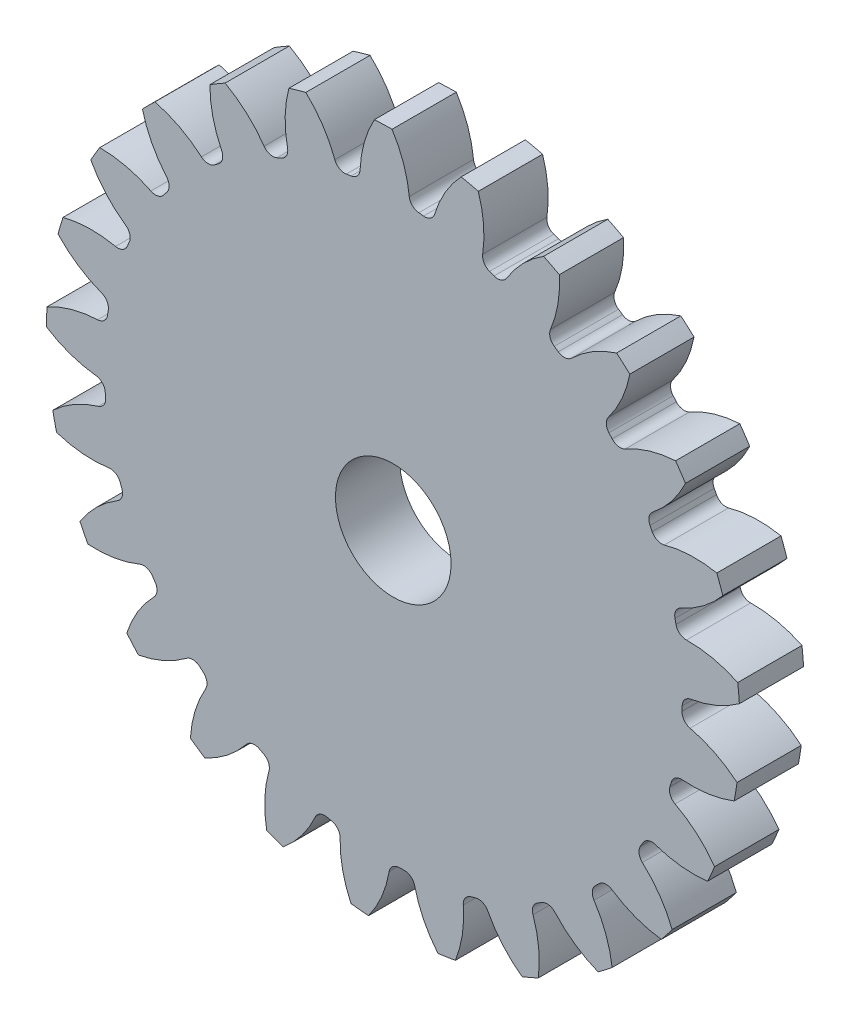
SolidWorks part; units mm, degrees
ref_plane "Front" through (0, 0, 0) normal (0, 0, 1) x (1, 0, 0)
ref_plane "Top" through (0, 0, 0) normal (0, 1, 0) x (1, 0, 0)
ref_plane "Right" through (0, 0, 0) normal (1, 0, 0) x (0, 0, -1)
sketch "Sketch3" plane through (0, 0, 0) normal (0, 0, 1) x (1, 0, 0)
  circle A0 centre (0, 0) radius 685.8
  dimension "od" = 1371.6
extrude "gearBody" add sketch "Sketch3" along normal blind 127
sketch "Sketch2" plane through (0, 0, 0) normal (0, 0, 1) x (1, 0, 0)
  line L0 (0, 0) -> (551.2834, 228.349) construction
  line L1 (681.0714, -92.9053) -> (0, 0) construction
  line L2 (0, 0) -> (36.3143, 0) construction
  line L3 (634.7401, 18.1669) -> (632.0519, -61.1178) construction
  line L5 (633.396, -21.4755) -> (0, 0) construction
  line L7 (0, 0) -> (596.7048, 0) construction
  arc A0 (596.666, 6.8045) -> (594.8349, -47.2027) centre (0, 0) ccw construction
  arc A1 (684.292, 45.4549) -> (679.6417, -91.6994) centre (0, 0) ccw construction
  arc A2 (634.7401, 18.1669) -> (632.0519, -61.1178) centre (0, 0) ccw construction
  arc A3 (570.9889, -24.1643) -> (571.3144, -14.5658) centre (0, 0) ccw
  arc A4 (681.0714, -92.9053) -> (586.8633, -45.1533) centre (534.5507, -265.1645) ccw
  arc A5 (681.0714, -92.9053) -> (685.8, 46.5612) centre (0, 0) ccw
  arc A6 (685.8, 46.5612) -> (588.5739, 5.2998) centre (551.2834, 228.349) cw
  arc A7 (571.3144, -14.5658) -> (588.5739, 5.2998) centre (591.9832, -15.0928) cw
  arc A8 (586.8633, -45.1533) -> (570.9889, -24.1643) centre (591.646, -25.0385) cw
  point P6 (685.8, 46.5612)
  point P22 (681.0714, -92.9053)
  dimension "baseDia" = 1193.4096
  dimension "od" = 1371.6
  dimension "pd" = 1270
  dimension "rd" = 1143
  dimension "rFillet" = 20.6756
  dimension "pointX" = 685.8
  dimension "pointY" = 46.5612
  dimension "CTT" = 79.2847
  dimension "flankCenterAngle" = 22.5
extrude "toothCut" cut sketch "Sketch2" along normal through all
pattern_circular "CirPattern1" count 25 over 360 about axis through (0, 0, 0) along (0, 0, 1) of "toothCut"
sketch "hub1Dia" plane through (0, 0, 0) normal (0, 0, -1) x (-1, 0, 0)
  circle A0 centre (0, 0) radius 12.7
  dimension "hub1Dia" = 25.4
sketch "hub2Dia" plane through (0, 0, 127) normal (0, 0, 1) x (1, 0, 0)
  circle A0 centre (0, 0) radius 12.7
  dimension "hub2dia" = 25.4
sketch "boreDia" plane through (0, 0, 0) normal (0, 0, 1) x (1, 0, 0)
  circle A0 centre (0, 0) radius 114.3
  dimension "boreDia" = 228.6
extrude "bore" cut sketch "boreDia" against normal mid plane 25400
